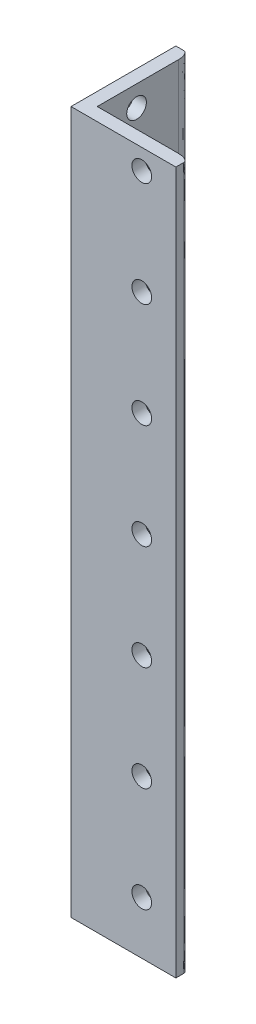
SolidWorks part; units mm, degrees
other "<Large L Bracket>-<Cut-Extrude2>"
ref_plane "Front Plane" through (0, 0, 0) normal (0, 0, 1) x (1, 0, 0)
ref_plane "Top Plane" through (0, 0, 0) normal (0, 1, 0) x (1, 0, 0)
ref_plane "Right Plane" through (0, 0, 0) normal (1, 0, 0) x (0, 0, -1)
mirrored part "Large L Bracket_Mirrored"
